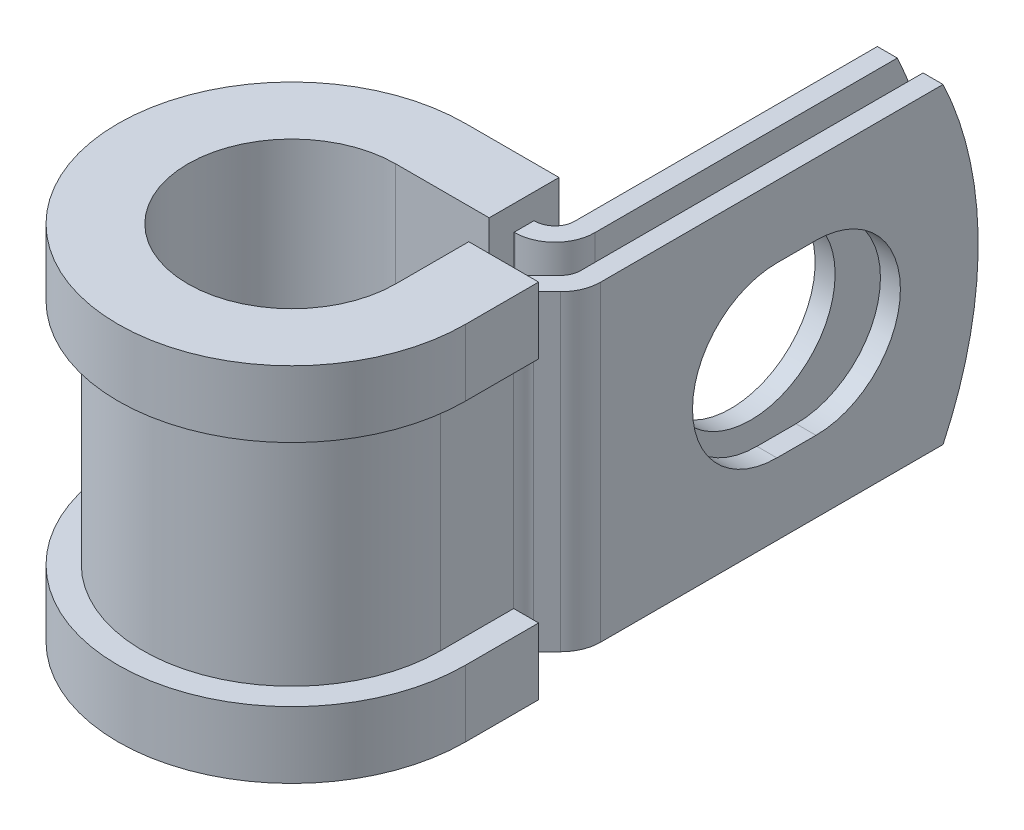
SolidWorks part; units mm, degrees
ref_plane "Front Plane" through (0, 0, 0) normal (0, 0, 1) x (1, 0, 0)
ref_plane "Top Plane" through (0, 0, 0) normal (0, 1, 0) x (1, 0, 0)
ref_plane "Right Plane" through (0, 0, 0) normal (1, 0, 0) x (0, 0, -1)
sketch "Sketch1" plane through (0, 0, 0) normal (0, 1, 0) x (1, 0, 0)
  line L0 (0, 7.874) -> (5.7583, 7.874)
  line L1 (7.874, 0) -> (7.874, 4.4615)
  line L2 (8.1967, 30.9372) -> (8.1967, 10.3124)
  line L3 (8.5882, 6.1857) -> (9.4144, 7.0119)
  line L5 (9.7715, 7.874) -> (9.7715, 30.9372)
  arc A0 (0, 7.874) -> (7.874, 0) centre (0, 0) ccw
  arc A1 (8.5882, 6.1857) -> (7.874, 4.4615) centre (10.3124, 4.4615) ccw
  arc A2 (9.4144, 7.0119) -> (9.7715, 7.874) centre (8.5523, 7.874) ccw
  arc A3 (5.7583, 7.874) -> (8.1967, 10.3124) centre (5.7583, 10.3124) ccw
extrude "Extrude-Thin1" add sketch "Sketch1" along normal mid plane 19.05 thin
sketch "Sketch2" plane through (6.9775, 0, 0) normal (-1, 0, 0) x (0, 0, 1)
  line L0 (-30.9372, 9.525) -> (-30.9372, -9.525) construction
  line L1 (0, 9.525) -> (0, -9.525) construction
  circle A0 centre (-19.8374, 0) radius 5.1562
  point P2 (-30.9372, 0)
extrude "Cut-Extrude1" cut sketch "Sketch2" against normal up to surface (1.2192 mm away)
sketch "Sketch3" plane through (10.9907, 0, 0) normal (1, 0, 0) x (0, 0, -1)
  line L0 (18.6436, 0) -> (21.0312, 0) construction
  line L1 (18.6436, 5.1562) -> (21.0312, 5.1562)
  line L2 (18.6436, -5.1562) -> (21.0312, -5.1562)
  line L3 (30.9372, 9.525) -> (30.9372, -9.525) construction
  arc A0 (18.6436, 5.1562) -> (18.6436, -5.1562) centre (18.6436, 0) ccw
  arc A1 (21.0312, -5.1562) -> (21.0312, 5.1562) centre (21.0312, 0) ccw
  point P3 (19.8374, 0)
  point P8 (30.9372, 0)
  point P11 (13.4874, 0)
  point P12 (26.1874, 0)
extrude "Cut-Extrude2" cut sketch "Sketch3" against normal up to surface (1.2192 mm away)
sketch "Sketch4" plane through (6.9775, 0, 0) normal (-1, 0, 0) x (0, 0, 1)
  line L0 (-30.9372, 9.525) -> (-30.9372, -9.525)
  line L1 (-30.9372, 9.525) -> (-28.7927, 9.525)
  line L2 (-30.9372, 9.525) -> (-10.3124, 9.525) construction
  line L3 (-30.9372, -9.525) -> (-28.7927, -9.525)
  line L4 (-30.9372, -9.525) -> (-10.3124, -9.525) construction
  arc A0 (-28.7927, 9.525) -> (-28.7927, -9.525) centre (-8.7122, 0) ccw
extrude "Cut-Extrude3" cut sketch "Sketch4" against normal through all contours A0 M4 M5 | A0 L0 M2
ref_plane "Plane1" through (0, 0, -4.4615) normal (0, 0, -1) x (-1, 0, 0)
ref_plane "Plane2" through (5.7075, 0, 0) normal (-1, 0, 0) x (0, 0, 1)
sketch "Sketch5" plane through (0, 0, -4.4615) normal (0, 0, -1) x (-1, 0, 0)
  line L0 (-9.0932, 9.525) -> (-7.874, 9.525)
  line L1 (-9.0932, 9.525) -> (-9.0932, -9.525) construction
  line L3 (-7.874, 9.525) -> (-7.874, -9.525)
  line L4 (-7.874, -9.525) -> (-9.0932, -9.525)
  line L5 (-9.0932, -9.525) -> (-9.0932, -6.985)
  line L6 (-9.0932, 9.525) -> (-9.0932, 6.985)
  line L7 (-10.6172, 11.049) -> (-10.6172, 6.985)
  line L8 (-10.6172, 11.049) -> (-6.35, 11.049)
  line L9 (-6.35, 11.049) -> (-6.35, -11.049)
  line L10 (-6.35, -11.049) -> (-10.6172, -11.049)
  line L11 (-10.6172, -11.049) -> (-10.6172, -6.985)
  line L12 (-10.6172, 6.985) -> (-9.0932, 6.985)
  line L13 (-9.0932, -6.985) -> (-10.6172, -6.985)
sketch "Sketch6" plane through (0, 9.525, 0) normal (0, 1, 0) x (1, 0, 0)
  line L0 (6.35, 0) -> (6.35, 4.4615)
  line L1 (6.35, 4.4615) -> (10.6172, 4.4615) construction
  line L2 (5.7075, 6.9878) -> (5.7075, -6.9878) construction
  line L5 (0, 6.35) -> (5.7075, 6.35)
  arc A0 (0, 6.35) -> (6.35, 0) centre (0, 0) ccw
sweep "Sweep1" add profiles "Sketch5" path "Sketch6"
equation "\"D4@Sketch5\" = \"D1@Extrude-Thin1\""
equation "\"D5@Sketch5\" = \"D5@Extrude-Thin1\""
equation "\"D1@Sketch3\" = \"D2@Sketch2\""
equation "\"D7@Sketch1\" = \"D3@Sketch2\" + \"D1@Sketch3\""
equation "\"D1@Sketch1\" = \"D1@Sketch6\" + 2 * \"D3@Sketch5\""
equation "\"D1@Sketch4\" = ( \"D1@Extrude-Thin1\" + .125 ) * 2"
equation "\"D9@Sketch1\"= \"D5@Extrude-Thin1\""
equation "\"D8@Sketch1\"= 2 * \"D5@Extrude-Thin1\""
equation "\"D2@Sketch1\" = 2 * \"D5@Extrude-Thin1\""
equation "\"D2@Sketch3\" = \"D1@Sketch2\""
